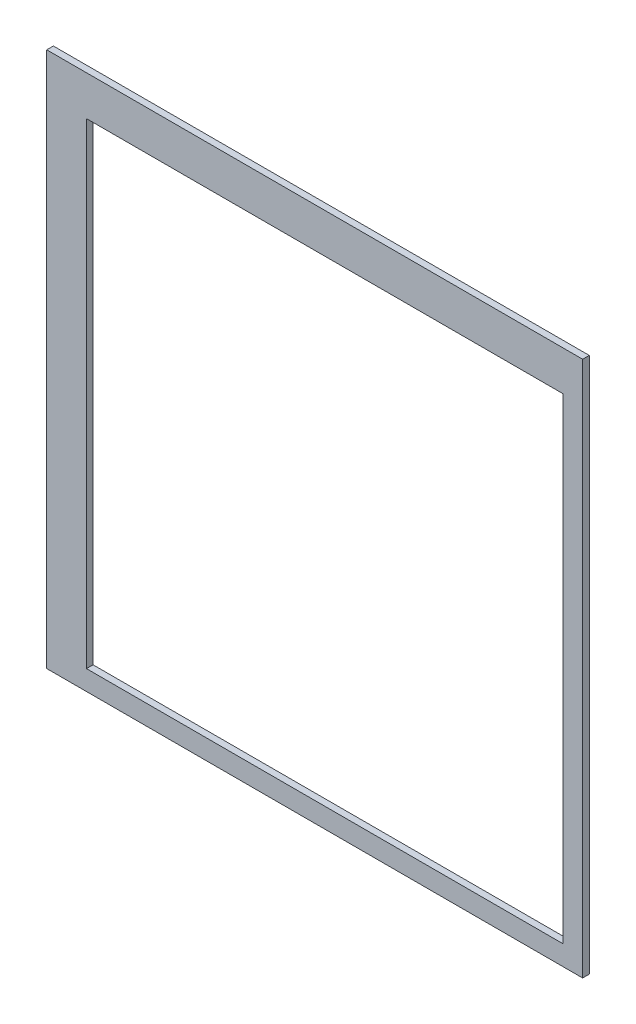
SolidWorks part; units mm, degrees
ref_plane "Front Plane" through (0, 0, 0) normal (0, 0, 1) x (1, 0, 0)
ref_plane "Top Plane" through (0, 0, 0) normal (0, 1, 0) x (1, 0, 0)
ref_plane "Right Plane" through (0, 0, 0) normal (1, 0, 0) x (0, 0, -1)
sketch "Sketch1" plane through (0, 0, 0) normal (0, 0, 1) x (1, 0, 0)
  line L0 (195, 210) -> (-210, 210)
  line L1 (180, -180) -> (-180, -180)
  line L2 (180, -180) -> (180, 180)
  line L3 (180, 180) -> (-180, 180)
  line L4 (-180, -180) -> (-180, 180)
  line L5 (180, -180) -> (-180, 180) construction
  line L6 (180, 180) -> (-180, -180) construction
  line L7 (-210, -195) -> (-210, 210)
  line L8 (195, -195) -> (195, 210)
  line L9 (195, -195) -> (-210, -195)
  line L10 (-210, -180) -> (-210, 210) construction
  line L11 (195, -195) -> (-180, -195) construction
  line L12 (180, 210) -> (-210, 210) construction
  line L13 (195, -195) -> (195, 180) construction
  point P0 (0, 0)
  point P12 (-210, -267.6599)
  point P14 (-266.0362, -195)
  point P16 (286.9157, 210)
  point P18 (195, 254.3577)
  dimension "D1" = 360
  dimension "D2" = 30
  dimension "D3" = 15
extrude "Boss-Extrude1" add sketch "Sketch1" along normal mid plane 5
